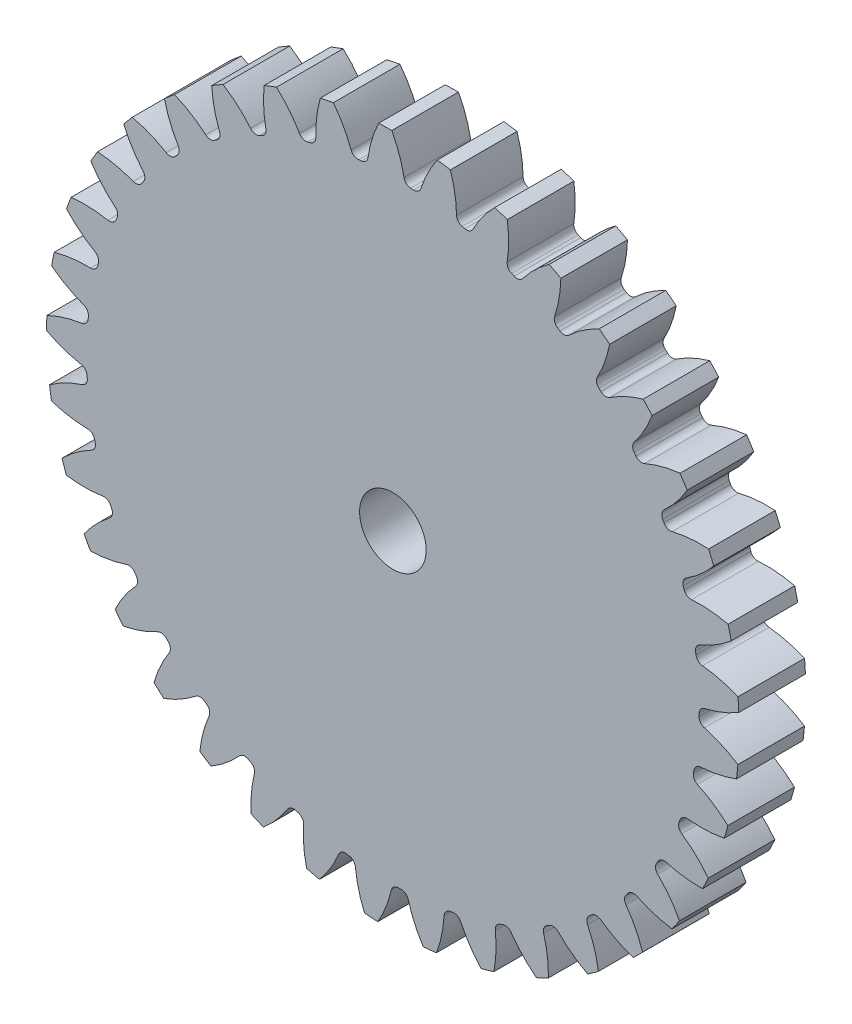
SolidWorks part; units mm, degrees
ref_plane "Front" through (0, 0, 0) normal (0, 0, 1) x (1, 0, 0)
ref_plane "Top" through (0, 0, 0) normal (0, 1, 0) x (1, 0, 0)
ref_plane "Right" through (0, 0, 0) normal (1, 0, 0) x (0, 0, -1)
sketch "Sketch3" plane through (0, 0, 0) normal (0, 0, 1) x (1, 0, 0)
  circle A0 centre (0, 0) radius 660.4
  dimension "od" = 1320.8
extrude "gearBody" add sketch "Sketch3" along normal blind 127
sketch "Sketch2" plane through (0, 0, 0) normal (0, 0, 1) x (1, 0, 0)
  line L0 (0, 0) -> (543.9329, 225.3044) construction
  line L1 (658.6171, -57.2385) -> (0, 0) construction
  line L2 (0, 0) -> (36.3143, 0) construction
  line L3 (626.3822, 13.7588) -> (625.3046, -39.2203) construction
  line L5 (625.8434, -12.7307) -> (0, 0) construction
  line L7 (0, 0) -> (588.7488, 0) construction
  arc A0 (588.7424, 2.7252) -> (588.1446, -26.6651) centre (0, 0) ccw construction
  arc A1 (659.7182, 30.0016) -> (657.9524, -56.8053) centre (0, 0) ccw construction
  arc A2 (626.3822, 13.7588) -> (625.3046, -39.2203) centre (0, 0) ccw construction
  arc A3 (584.018, -14.5813) -> (584.1279, -9.1808) centre (0, 0) ccw
  arc A4 (658.6171, -57.2385) -> (594.1644, -28.2216) centre (534.3206, -247.2379) ccw
  arc A5 (658.6171, -57.2385) -> (660.4, 30.4074) centre (0, 0) ccw
  arc A6 (660.4, 30.4074) -> (594.8205, 4.0356) centre (543.9329, 225.3044) cw
  arc A7 (584.1279, -9.1808) -> (594.8205, 4.0356) centre (597.9099, -9.3974) cw
  arc A8 (594.1644, -28.2216) -> (584.018, -14.5813) centre (597.7974, -14.9253) cw
  point P6 (660.4, 30.4074)
  point P22 (658.6171, -57.2385)
  dimension "baseDia" = 1177.4975
  dimension "od" = 1320.8
  dimension "pd" = 1253.0667
  dimension "rd" = 1168.4
  dimension "rFillet" = 13.7837
  dimension "pointX" = 660.4
  dimension "pointY" = 30.4074
  dimension "CTT" = 52.9791
  dimension "flankCenterAngle" = 22.5
extrude "toothCut" cut sketch "Sketch2" along normal through all
pattern_circular "CirPattern1" count 37 over 360 about axis through (0, 0, 0) along (0, 0, 1) of "toothCut"
sketch "hub1Dia" plane through (0, 0, 0) normal (0, 0, -1) x (-1, 0, 0)
  circle A0 centre (0, 0) radius 12.7
  dimension "hub1Dia" = 25.4
sketch "hub2Dia" plane through (0, 0, 127) normal (0, 0, 1) x (1, 0, 0)
  circle A0 centre (0, 0) radius 12.7
  dimension "hub2dia" = 25.4
sketch "boreDia" plane through (0, 0, 0) normal (0, 0, 1) x (1, 0, 0)
  circle A0 centre (0, 0) radius 63.5
  dimension "boreDia" = 127
extrude "bore" cut sketch "boreDia" against normal mid plane 25400
